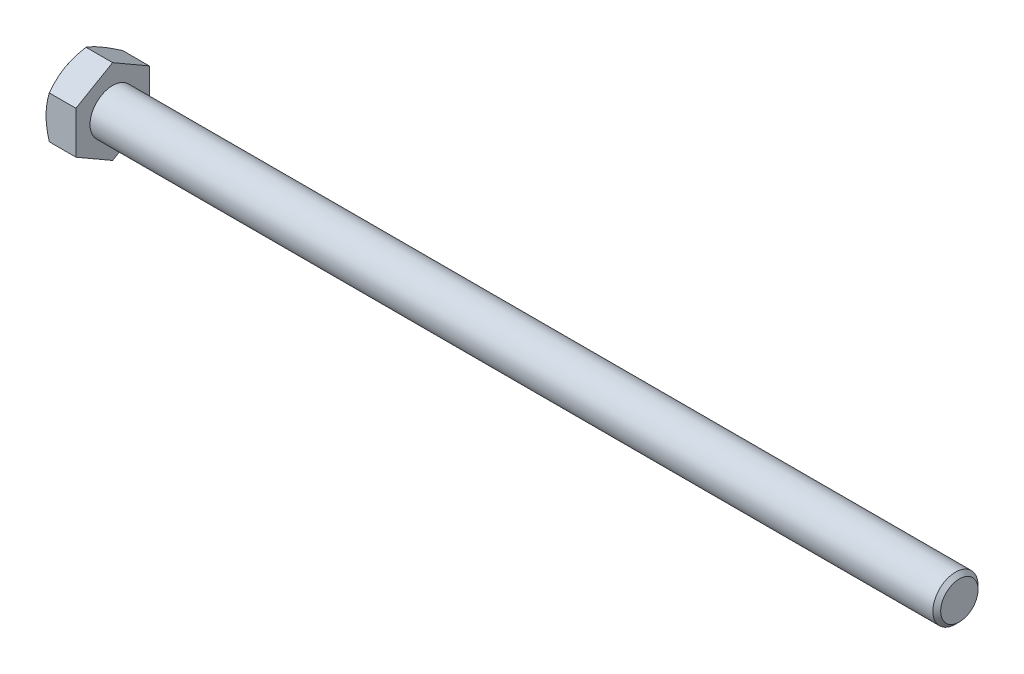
SolidWorks part; units mm, degrees
ref_plane "Plane1" through (0, 0, 0) normal (0, 0, 1) x (1, 0, 0)
ref_plane "Plane2" through (0, 0, 0) normal (0, 1, 0) x (1, 0, 0)
ref_plane "Plane3" through (0, 0, 0) normal (1, 0, 0) x (0, 0, -1)
extrude "BaseHead" add sketch "Sketch1" along normal blind 5.3
sketch "Sketch1" plane through (0, 0, 0) normal (1, 0, 0) x (0, 0, -1)
  line L0 (6.5, 3.7528) -> (6.5, -3.7528)
  line L1 (-6.5, 3.7528) -> (-6.5, -3.7528)
  line L2 (6.5, -3.7528) -> (0, -7.5056)
  line L3 (0, -7.5056) -> (-6.5, -3.7528)
  line L4 (6.5, 3.7528) -> (0, 7.5056)
  line L5 (0, 7.5056) -> (-6.5, 3.7528)
  dimension "Width_flats" = 13
  dimension "D2" = 120
  dimension "D3" = 6.5
  dimension "D4" = 6.5
  dimension "D5" = 6.5
revolve "BaseBody" add sketch "BodySke" angle 360 about L7
sketch "BodySke" plane through (0, 0, 0) normal (0, 0, 1) x (1, 0, 0)
  line L1 (0, 0) -> (155.3, 0)
  line L2 (0, 0) -> (0, 4)
  line L4 (155.3, 0) -> (155.3, 3.3095)
  line L5 (5.3, 7.5056) -> (5.3, 3.7528) construction
  line L6 (155.3, 3.3095) -> (154.6095, 4)
  line L7 (0, 0) -> (110.49, 0) construction
  line L8 (155.3, -3.3095) -> (154.6095, -4) construction
  line L9 (0, 3.7528) -> (0, -3.7528) construction
  line L10 (6.55, 15.24) -> (6.55, -1.27) construction
  line L11 (125.3, 15.24) -> (125.3, -1.27) construction
  line L12 (5.3, 3.7528) -> (5.3, -3.7528) construction
  line L15 (0, 4) -> (154.6095, 4)
  dimension "Length" = 150
  dimension "Body_ch_ang" = 45
  dimension "Diameter" = 8
  dimension "Minor_dia" = 6.619
  dimension "Advance" = 1.25
  dimension "Thread_nom" = 30
fillet "HeadFillet" [suppressed] radius 0.4
sketch "Sketch3" plane through (0, 0, 0) normal (0, 0, 1) x (1, 0, 0)
  line L0 (0, 6.5) -> (3.4673, 12.5056)
  line L1 (0, 7.5056) -> (0, 3.7528) construction
  line L2 (3.4673, 12.5056) -> (3.4673, 17.5056)
  line L3 (3.4673, 17.5056) -> (-10, 17.5056)
  line L4 (-10, 17.5056) -> (-10, 6.5)
  line L5 (-10, 6.5) -> (0, 6.5)
  line L6 (0, 0) -> (99.06, 0) construction
  line L7 (5.3, 7.5056) -> (0, 7.5056) construction
  dimension "D1" = 6.5
  dimension "D2" = 5
  dimension "D3" = 10
  dimension "D4" = 5
  dimension "Head_ch_ang" = 30
revolve "HeadChamfer" cut sketch "Sketch3" angle 360 about L6
sketch "ThdSchSke" plane through (0, 0, 0) normal (0, 0, 1) x (1, 0, 0)
  line L0 (125.3, -3.3095) -> (124.8165, -4)
  line L1 (125.3, -3.3095) -> (125.7835, -4)
  line L2 (125.7835, -4) -> (125.7835, -5)
  line L3 (-3.175, 0) -> (5.1513, 0) construction
  line L5 (125.7835, -5) -> (124.8165, -5)
  line L6 (124.8165, -5) -> (124.8165, -4)
  dimension "Thread_minor" = 6.619
  dimension "Diameter" = 8
  dimension "Start" = 125.3
  dimension "SideAngle" = 55
  dimension "VeeAngle" = 70
  dimension "Overcut" = 10
revolve "ThreadSchematic" [suppressed] cut sketch "ThdSchSke" angle 360 about L3
pattern_linear "ThdSchPat" [suppressed]
equation "\"D3@Sketch1\" = \"Width_flats@Sketch1\" / 2"
equation "\"D4@Sketch1\" = \"D3@Sketch1\""
equation "\"D5@Sketch1\" = \"D4@Sketch1\""
equation "\"Thread_minor@ThreadCosmetic\" = \"Minor_dia@BodySke\""
equation "\"D1@Sketch3\" = \"Width_flats@Sketch1\" / 2"
equation "\"Thread_length@ThreadCosmetic\" = ((sgn( (\"Length@BodySke\" - \"Advance@BodySke\" ) - \"Thread_nom@BodySke\" )-1)*( (\"Length@BodySke\" - \"Advance@BodySke\" ) - \"Thread_nom@BodySke\" ))/-2+ \"Thread_nom@BodySke\""
equation "\"Thread_minor@ThdSchSke\" = \"Minor_dia@BodySke\""
equation "\"Diameter@ThdSchSke\" = \"Diameter@BodySke\""
equation "\"Overcut@ThdSchSke\" = \"Diameter@BodySke\" * 1.25"
equation "\"Start@ThdSchSke\" = \"Head_ht@BaseHead\" + \"Length@BodySke\" - \"Thread_length@ThreadCosmetic\"  '---Non-countersunk---"
equation "\"Num_threads@ThdSchPat\" = int( \"Thread_length@ThreadCosmetic\" / \"Advance@BodySke\" + 0.999 )  + 1"
equation "\"Advance@ThdSchPat\" = \"Thread_length@ThreadCosmetic\" /  (\"Num_threads@ThdSchPat\" - 1) 'relax it"
equation "\"Num_threads@ThdSchPat\" = \"Num_threads@ThdSchPat\" - sgn( \"Num_threads@ThdSchPat\" - 1) '---chamfered tips only---"
